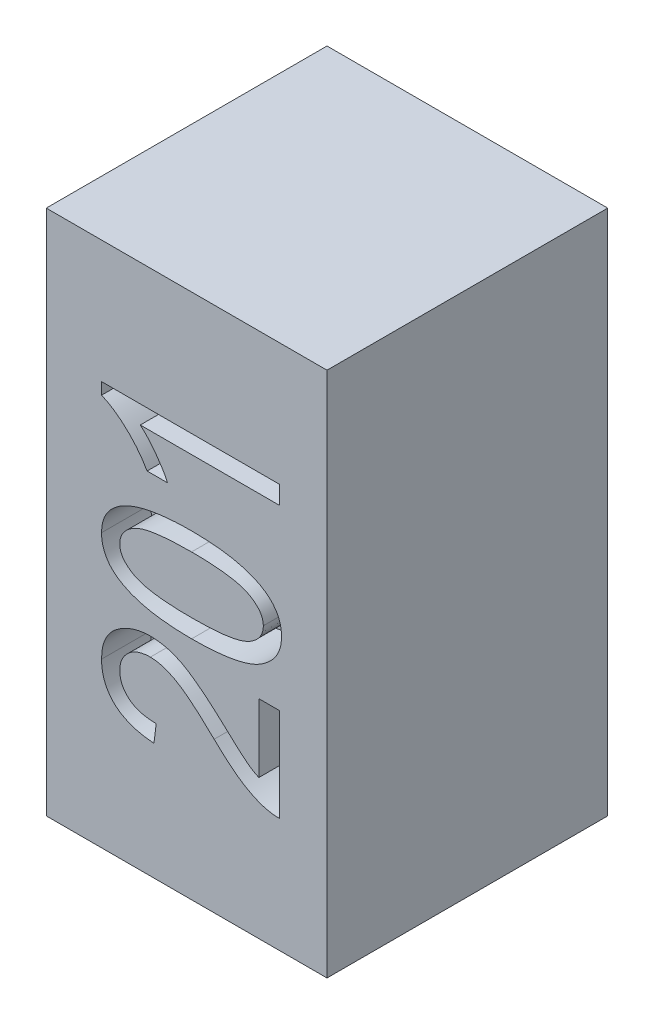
SolidWorks part; units mm, degrees
ref_plane "Plan de face" through (0, 0, 0) normal (0, 0, 1) x (1, 0, 0)
ref_plane "Plan de dessus" through (0, 0, 0) normal (0, 1, 0) x (1, 0, 0)
ref_plane "Plan de droite" through (0, 0, 0) normal (1, 0, 0) x (0, 0, -1)
sketch "Esquisse1" plane through (0, 0, 0) normal (0, 0, 1) x (1, 0, 0)
  line L0 (-1.3836, 0) -> (1.5164, 0) construction
  line L1 (0, 1.23) -> (0, -1.03) construction
  line L3 (-0.4, 0.75) -> (0.4, 0.75)
  line L4 (-0.4, 0.75) -> (-0.4, -0.75)
  line L5 (-0.4, -0.75) -> (0.4, -0.75)
  line L6 (0.4, 0.75) -> (0.4, -0.75)
  dimension "D1" = 1.5
  dimension "D2" = 0.8
extrude "Boss.-Extru.1" add sketch "Esquisse1" along normal blind 0.8
sketch "Esquisse2" plane through (0, 0, 0.8) normal (0, 0, 1) x (1, 0, 0)
  line L0 (0.264, -0.45) -> (0.264, 0.3069) construction
  line L1 (0.4, -0.75) -> (0.4, 0.75) construction
  line L2 (-0.4, -0.75) -> (0.4, -0.75) construction
  text T0 "201" font "Arial Narrow" height 0.5
  dimension "D1" = 0.136
  dimension "D2" = 0.3
extrude "Enlèv. mat.-Extru.1" cut sketch "Esquisse2" against normal blind 0.14
